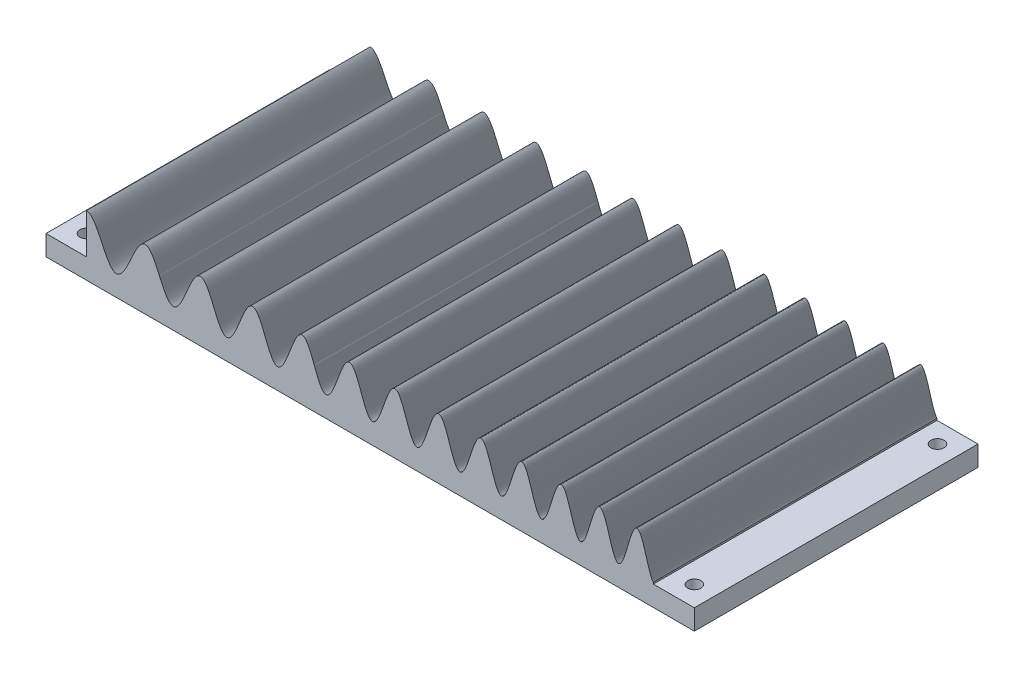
SolidWorks part; units mm, degrees
ref_plane "Front Plane" through (0, 0, 0) normal (0, 0, 1) x (1, 0, 0)
ref_plane "Top Plane" through (0, 0, 0) normal (0, 1, 0) x (1, 0, 0)
ref_plane "Right Plane" through (0, 0, 0) normal (1, 0, 0) x (0, 0, -1)
sketch "Model"
  dimension "D1" = 320
extrude "Boss-Extrude2" add sketch "Model" along normal blind 140
sketch "Sketch1" plane through (0, 0, 0) normal (0, 1, 0) x (1, 0, 0)
  line L0 (300, 0) -> (279.7515, 0) construction
  line L1 (300, -140) -> (300, 0) construction
  line L2 (300, -140) -> (279.7515, -140) construction
  line L3 (-20, -140) -> (-20, 0) construction
  line L4 (0, -140) -> (-20, -140) construction
  circle A0 centre (290, -10) radius 3.25
  circle A1 centre (290, -130) radius 3.25
  circle A3 centre (-10, -130) radius 3.25
  circle A4 centre (-10, -10) radius 3.25
  dimension "D1" = 6.5
  dimension "D2" = 6.5
  dimension "D9" = 6.5
  dimension "D12" = 6.5
  dimension "D3" = 10
  dimension "D4" = 10
  dimension "D5" = 10
  dimension "D6" = 10
  dimension "D7" = 10
  dimension "D8" = 10
  dimension "D10" = 120
  dimension "D11" = 300
extrude "Cut-Extrude1" cut sketch "Sketch1" against normal through all both and the other way through all
